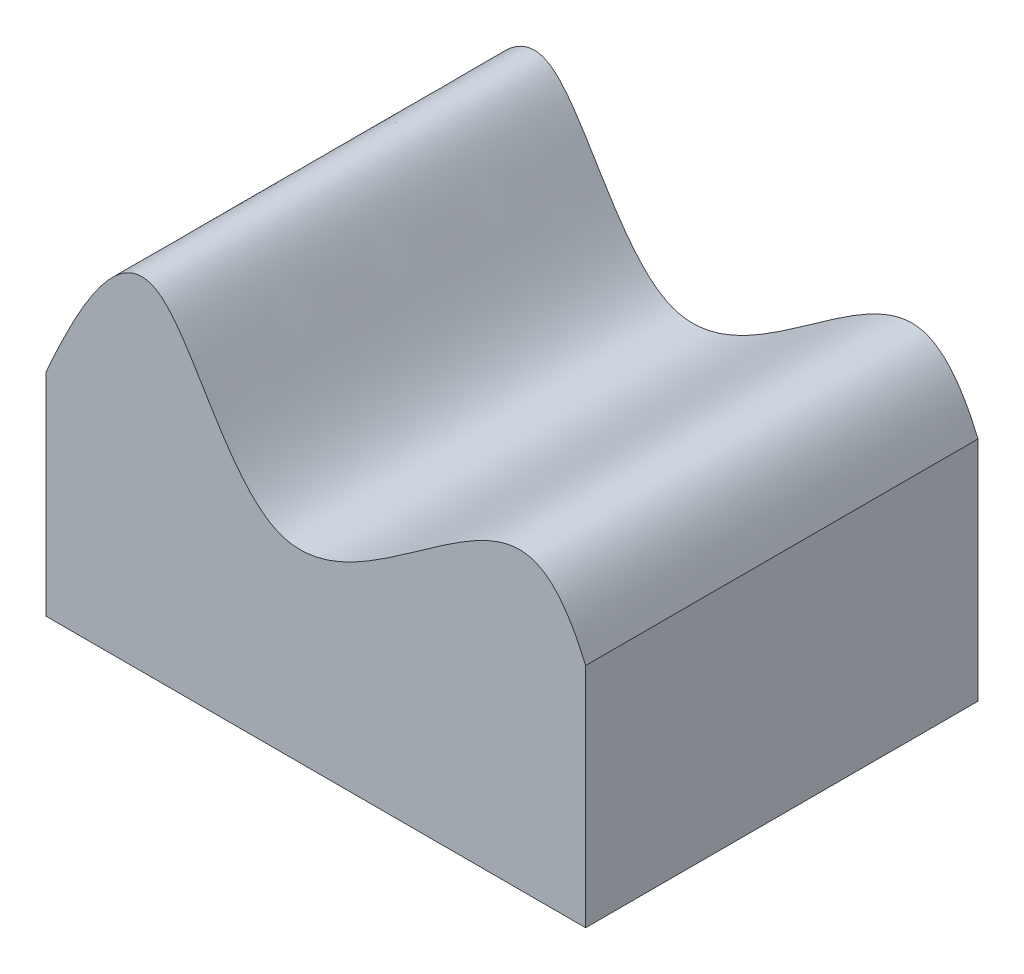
SolidWorks part; units mm, degrees
ref_plane "Front" through (0, 0, 0) normal (0, 0, 1) x (1, 0, 0)
ref_plane "Top" through (0, 0, 0) normal (0, 1, 0) x (1, 0, 0)
ref_plane "Right" through (0, 0, 0) normal (1, 0, 0) x (0, 0, -1)
sketch "Sketch1" plane through (0, 0, 0) normal (0, 0, 1) x (1, 0, 0)
  line L0 (60.6854, -29.9964) -> (-60.6854, 29.9964) construction
  line L1 (-60.6854, -29.9964) -> (60.6854, -29.9964)
  line L2 (-60.6854, -29.9964) -> (-60.6854, 29.9964)
  line L3 (-60.6854, 29.9964) -> (60.6854, 29.9964)
  line L4 (60.6854, -29.9964) -> (60.6854, 29.9964)
extrude "Extrude1" add sketch "Sketch1" along normal mid plane 88.2561
sketch "Sketch3" plane through (0, 0, 0) normal (0, 0, 1) x (1, 0, 0)
  spline_without_curve S0
surface "Surface-Extrude2" sketch "Sketch3" parameters "D1"=141.0277
other "Replace Face1"
